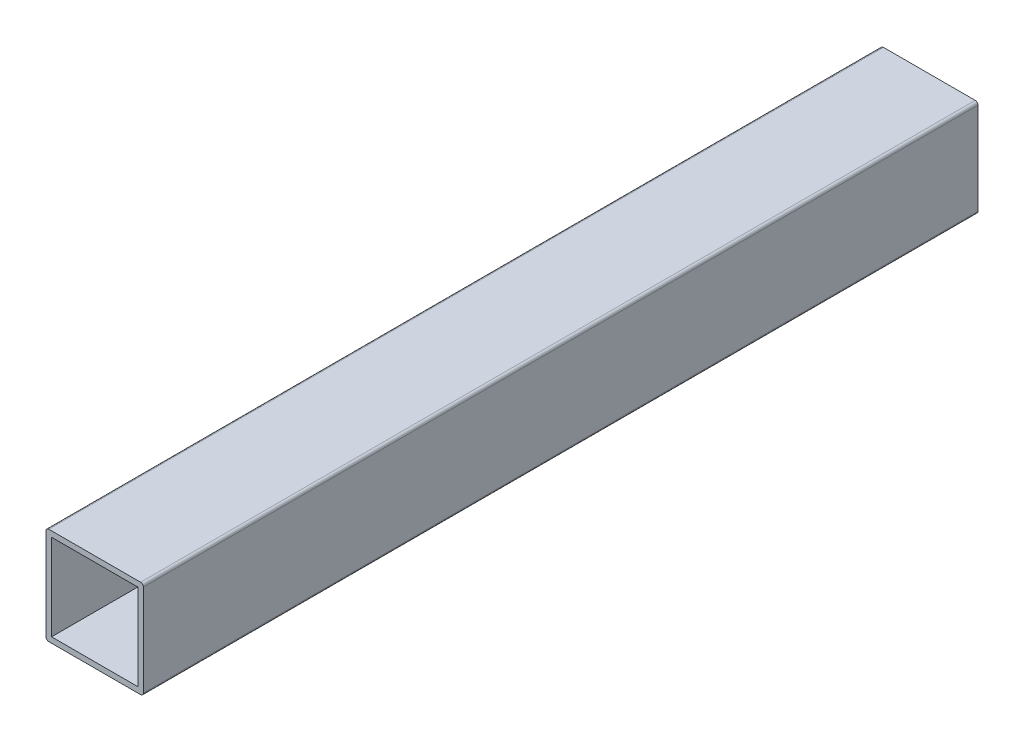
SolidWorks part; units mm, degrees
ref_plane "Plan1" through (0, 0, 0) normal (0, 0, 1) x (1, 0, 0)
ref_plane "Plan2" through (0, 0, 0) normal (0, 1, 0) x (1, 0, 0)
ref_plane "Plan3" through (0, 0, 0) normal (1, 0, 0) x (0, 0, -1)
sketch "Esquisse1" plane through (0, 0, 0) normal (0, 0, 1) x (1, 0, 0)
  line L0 (-16.5, 17.5) -> (16.5, 17.5)
  line L1 (-17.5, 16.5) -> (-17.5, -16.5)
  line L2 (16.5, -17.5) -> (-16.5, -17.5)
  line L3 (17.5, -16.5) -> (17.5, 16.5)
  line L4 (16.5, 16.5) -> (-16.5, -16.5) construction
  arc A0 (-16.5, -17.5) -> (-17.5, -16.5) centre (-16.5, -16.5) cw
  arc A1 (-17.5, 16.5) -> (-16.5, 17.5) centre (-16.5, 16.5) cw
  arc A2 (17.5, 16.5) -> (16.5, 17.5) centre (16.5, 16.5) ccw
  arc A3 (17.5, -16.5) -> (16.5, -17.5) centre (16.5, -16.5) cw
  dimension "D1" = 1
  dimension "D2" = 35
extrude "Base-Extru.-Mince" add sketch "Esquisse1" along normal blind 300 thin
